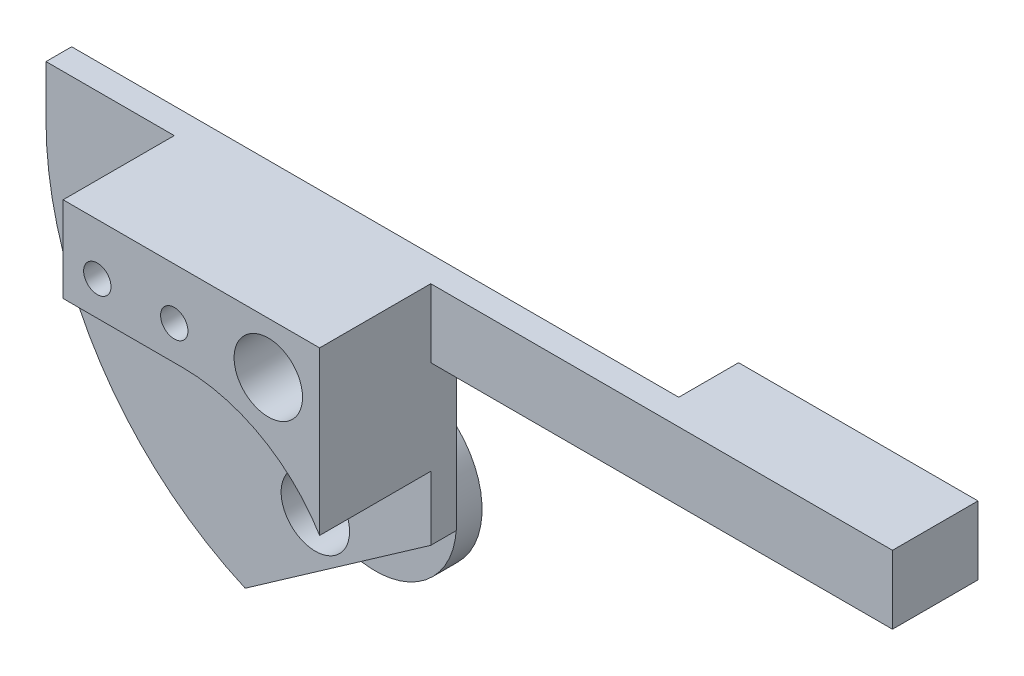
SolidWorks part; units mm, degrees
ref_plane "Plan de face" through (0, 0, 0) normal (0, 0, 1) x (1, 0, 0)
ref_plane "Plan de dessus" through (0, 0, 0) normal (0, 1, 0) x (1, 0, 0)
ref_plane "Plan de droite" through (0, 0, 0) normal (1, 0, 0) x (0, 0, -1)
sketch "Esquisse1" plane through (0, 0, 0) normal (0, 0, 1) x (1, 0, 0)
  line L0 (15.5, 68) -> (15.5, 71)
  line L1 (38, 48.7322) -> (38, 67)
  line L2 (15.5, 71) -> (65, 71)
  line L5 (32, 71) -> (15.5, 71) construction
  line L8 (38, 67) -> (65, 67)
  line L9 (65, 71) -> (65, 67)
  circle A0 centre (35, 68) radius 2
  arc A1 (15.5, 68) -> (38, 48.7322) centre (35, 68) ccw
  circle A4 centre (35, 68) radius 1.25 construction
  dimension "D1" = 4
  dimension "D2" = 19.5
  dimension "D3" = 22.5
  dimension "D4" = 4
  dimension "D6" = 49.5
extrude "Boss.-Extru.1" add sketch "Esquisse1" along normal blind 1.5
sketch "Esquisse2" plane through (0, 0, 1.5) normal (0, 0, 1) x (1, 0, 0)
  line L0 (23, 71) -> (38, 71)
  line L2 (38, 71) -> (38, 61.5)
  line L3 (38, 48.7322) -> (38, 67) construction
  line L4 (23, 71) -> (23, 66)
  line L5 (23, 66) -> (30, 66)
  line L6 (65, 71) -> (15.5, 71) construction
  arc A0 (38, 61.5) -> (30, 66) centre (30, 56.6389) ccw
  circle A1 centre (35, 68) radius 2
  circle A2 centre (35, 68) radius 2 construction
  dimension "D4" = 7
  dimension "D1" = 15
  dimension "D2" = 5
  dimension "D3" = 9.5
extrude "Boss.-Extru.2" add sketch "Esquisse2" along normal blind 6.5
sketch "Esquisse3" plane through (0, 0, 0) normal (0, 0, -1) x (-1, 0, 0)
  line L0 (-38, 67) -> (-65, 67) construction
  line L1 (-65, 71) -> (-51, 71)
  line L2 (-65, 71) -> (-65, 67)
  line L3 (-65, 67) -> (-51, 67)
  line L4 (-51, 71) -> (-51, 67)
  dimension "D1" = 14
extrude "Boss.-Extru.3" add sketch "Esquisse3" along normal blind 3.5
sketch "Esquisse4" plane through (0, 67, 0) normal (0, -1, 0) x (1, 0, 0)
  line L0 (65, -1) -> (51, -1) construction
  line L1 (65, 1.5) -> (65, -3.5) construction
  line L2 (51, -3.5) -> (51, 0) construction
  circle A0 centre (58, -1) radius 2
  dimension "D1" = 4
extrude "Enlèv. mat.-Extru.1" cut sketch "Esquisse4" against normal blind 3
sketch "Esquisse5" plane through (0, 0, 0) normal (0, 0, -1) x (-1, 0, 0)
  circle A0 centre (-31.25, 56.0758) radius 4.75
  arc A2 (-32.675, 60.607) -> (-29.825, 51.5445) centre (-31.25, 56.0758) ccw construction
  circle A3 centre (-31.25, 56.0758) radius 2
  dimension "D1" = 4
extrude "Boss.-Extru.4" add sketch "Esquisse5" along normal blind 3.5
sketch "Esquisse6" plane through (0, 0, 0) normal (0, 0, -1) x (-1, 0, 0)
  circle A0 centre (-31.25, 56.0758) radius 2
  circle A1 centre (-31.25, 56.0758) radius 2 construction
extrude "Enlèv. mat.-Extru.2" cut sketch "Esquisse6" against normal blind 3.5
hole_wizard "Trou taraudé M21" positions "Esquisse8" profile "Esquisse7" tap size "M2" standard "Iso"
sketch "Esquisse8" plane through (0, 0, 8) normal (0, 0, 1) x (1, 0, 0)
  circle A0 centre (29.5, 68) radius 1.2 construction
  circle A1 centre (25, 68) radius 1.2 construction
  point P0 (25, 68)
  point P2 (25, 68)
  point P5 (29.5, 68)
sketch "Esquisse7" plane through (25, 68, 8) normal (1, 0, 0) x (0, -1, 0)
  line L0 (0, 0) -> (0, 4.4807)
  line L1 (0, 4.4807) -> (0.8, 4)
  line L2 (0.8, 4) -> (0.8, 0)
  line L5 (0.8, 0) -> (0, 0)
  line L10 (0, 4.4807) -> (-0.8, 4) construction
  line L11 (0, -6.35) -> (0, 107.95) construction
  dimension "Diamètre du trou pour taraudage" = 1.6
  dimension "Profondeur du trou pour taraudage" = 4
  dimension "Angle de pointe" = 118
sketch "Esquisse9" plane through (0, 0, 1.5) normal (0, 0, 1) x (1, 0, 0)
  line L0 (38, 57.7502) -> (23.9004, 47.8776)
  line L1 (23.9004, 47.8776) -> (38, 47.8776)
  line L2 (38, 47.8776) -> (38, 57.7502)
  line L3 (38, 48.7322) -> (38, 61.5) construction
  circle A1 centre (31.25, 56.0758) radius 2 construction
  dimension "D2" = 2.5
  dimension "D1" = 125
extrude "Enlèv. mat.-Extru.3" cut sketch "Esquisse9" against normal blind 3.5
